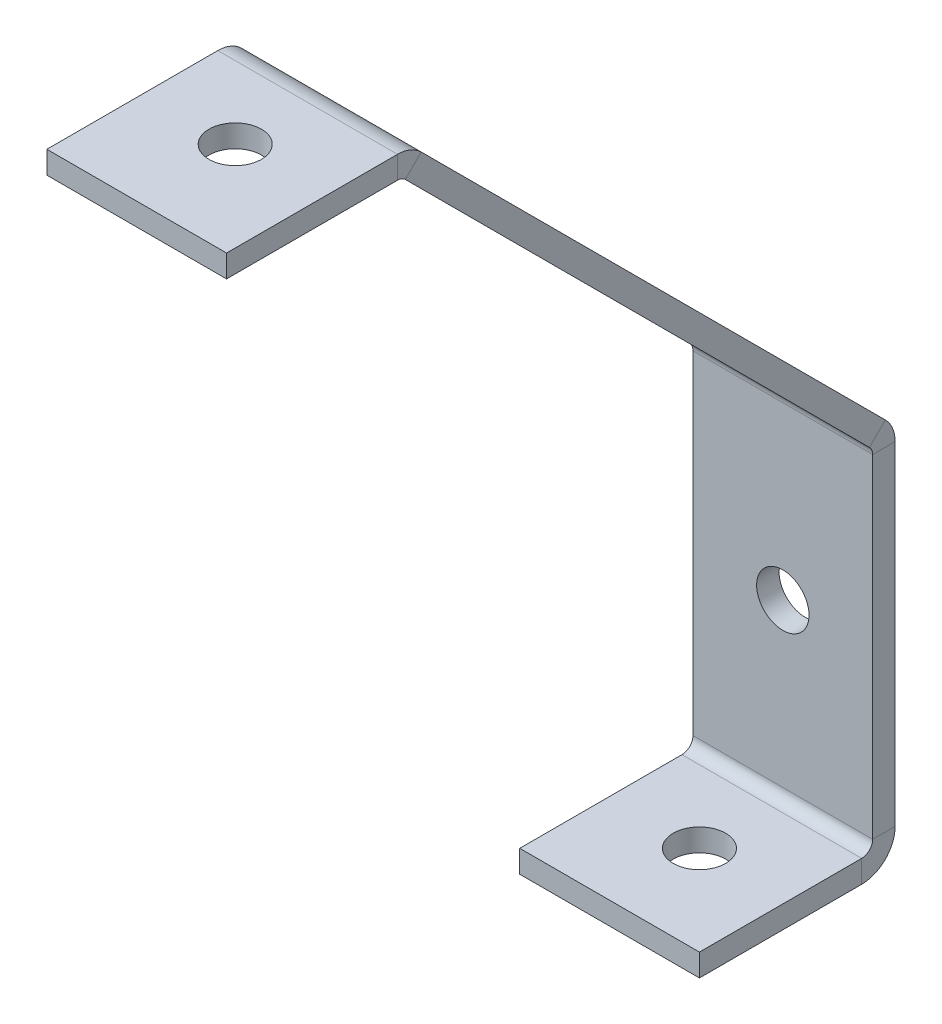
SolidWorks part; units mm, degrees
ref_plane "Front Plane" through (0, 0, 0) normal (0, 0, 1) x (1, 0, 0)
ref_plane "Top Plane" through (0, 0, 0) normal (0, 1, 0) x (1, 0, 0)
ref_plane "Right Plane" through (0, 0, 0) normal (1, 0, 0) x (0, 0, -1)
sketch "Sketch1" plane through (0, 0, 0) normal (0, 1, 0) x (1, 0, 0)
  line L0 (0, 86.422) -> (12, 86.422) construction
  line L1 (0, 0) -> (12, 0)
  line L2 (0, 0) -> (0, 93)
  line L3 (0, 93) -> (12, 93)
  line L4 (12, 0) -> (12, 93)
  line L5 (0, 6) -> (12, 6) construction
  line L6 (0, 24) -> (12, 24) construction
  circle A0 centre (6, 86.422) radius 1.75
  circle A1 centre (6, 24) radius 1.75
  circle A2 centre (6, 6) radius 1.75
  dimension "D3" = 6.578
  dimension "D1" = 12
  dimension "D2" = 93
sheet metal parameters "Sheet-Metal1" thickness 1.5 parameters "D1"=0.01
base flange "Base-Flange1" sketch "Sketch1" thickness 1.5 reverse thickness direction yes parameters "D1"=0.01
sketch "Sketch3" plane through (0, 1.5, 0) normal (0, 1, 0) x (-1, 0, 0)
  line L1 (0, -81) -> (-12, -81)
  line L2 (0, -36) -> (-12, -36)
sketched bend "Sketched Bend4" parameters "D1"=0.7366
bend "SketchBend4" bend radius 0.7366 bend angle 45 parameters "D5"=1
bend "SketchBend5" bend radius 0.7366 bend angle 45 parameters "D5"=2
sketch "Sketch4" plane through (0, 1.5, 0) normal (0, 1, 0) x (-1, 0, 0)
  line L1 (0, -12) -> (-12, -12)
sketched bend "Sketched Bend5" parameters "D1"=0.7366
bend "SketchBend6" bend radius 0.7366 bend angle 90 parameters "D5"=3
flat pattern "Flat-Pattern1"
sketch "Bend-Lines1" plane through (0, 0, 0) normal (0, 1, 0) x (-1, 0, 0)
bend of the flat pattern "Flatten-<SketchBend4>1"
bend of the flat pattern "Flatten-<SketchBend5>1"
bend of the flat pattern "Flatten-<SketchBend6>1"
